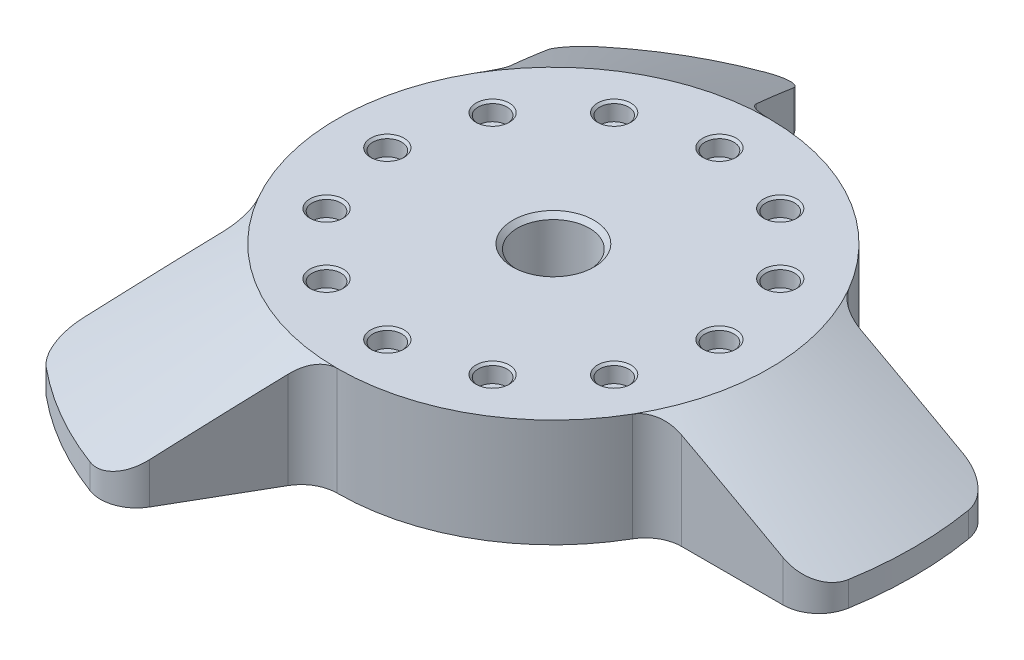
SolidWorks part; units mm, degrees
ref_plane "Front Plane" through (0, 0, 0) normal (0, 0, 1) x (1, 0, 0)
ref_plane "Top Plane" through (0, 0, 0) normal (0, 1, 0) x (1, 0, 0)
ref_plane "Right Plane" through (0, 0, 0) normal (1, 0, 0) x (0, 0, -1)
sketch "Sketch1" plane through (0, 0, 0) normal (0, 1, 0) x (1, 0, 0)
  circle A0 centre (0, 0) radius 38.1
  circle A1 centre (0, 0) radius 6.35
  dimension "D1" = 76.2
  dimension "D2" = 12.7
extrude "Boss-Extrude1" add sketch "Sketch1" along normal blind 19.05
sketch "Sketch2" plane through (0, 0, 0) normal (0, -1, 0) x (1, 0, 0)
  line L0 (0, 0) -> (63.5, 0) construction
  line L1 (34.6352, -15.875) -> (61.4836, -15.875)
  line L2 (34.6352, 15.875) -> (61.4836, 15.875)
  line L3 (-31.0657, -22.0574) -> (-44.49, -45.3089)
  line L4 (-3.5694, -37.9324) -> (-16.9937, -61.1839)
  line L5 (-3.5694, 37.9324) -> (-16.9937, 61.1839)
  line L6 (-31.0657, 22.0574) -> (-44.49, 45.3089)
  line L7 (-31.75, 54.9926) -> (0, 0) construction
  arc A1 (61.4836, -15.875) -> (61.4836, 15.875) centre (0, 0) ccw
  circle A2 centre (0, 0) radius 38.1 construction
  arc A3 (34.6352, -15.875) -> (34.6352, 15.875) centre (0, 0) ccw
  arc A4 (-44.49, -45.3089) -> (-16.9937, -61.1839) centre (0, 0) ccw
  arc A5 (-31.0657, -22.0574) -> (-3.5694, -37.9324) centre (0, 0) ccw
  arc A6 (-16.9937, 61.1839) -> (-44.49, 45.3089) centre (0, 0) ccw
  arc A7 (-3.5694, 37.9324) -> (-31.0657, 22.0574) centre (0, 0) ccw
  dimension "D1" = 63.5
  dimension "D2" = 31.75
  dimension "D4" = 120
  dimension "D3" = 3
extrude "Boss-Extrude2" add sketch "Sketch2" against normal up to surface (19.05 mm away)
chamfer "Chamfer1" distance 25.4 angle 30 3 edges at (63.5, 19.05, 0) (-31.75, 19.05, -54.9926) (-31.75, 19.05, 54.9926)
fillet "Fillet1" radius 6.35 12 edges at (-31.0657, 9.525, 22.0574) (-31.0657, 9.525, -22.0574) (-3.5694, 9.525, -37.9324) (34.6352, 9.525, -15.875) (34.6352, 9.525, 15.875) (-3.5694, 9.525, 37.9324) (61.4836, 2.1927, 15.875) (61.4836, 2.1927, -15.875) (-16.9937, 2.1927, -61.1839) (-44.49, 2.1927, -45.3089) (-44.49, 2.1927, 45.3089) (-16.9937, 2.1927, 61.1839)
chamfer "Chamfer2" distance 0.8128 angle 45 2 edges at (0, 19.05, 6.35) (0, 0, 6.35)
sketch "Sketch3" plane through (0, 19.05, 0) normal (0, 1, 0) x (1, 0, 0)
  line L0 (0, 0) -> (-14.6368, -25.3516) construction
  line L1 (0, 0) -> (0, -29.2735) construction
  circle A1 centre (-14.6368, -25.3516) radius 2.54
  circle A2 centre (0, 0) radius 29.2735 construction
  arc A3 (32.9956, 19.05) -> (0, 38.1) centre (0, 0) ccw construction
  circle A4 centre (-25.3516, -14.6367) radius 2.54
  circle A5 centre (-29.2735, 0) radius 2.54
  circle A6 centre (-25.3516, 14.6368) radius 2.54
  circle A7 centre (-14.6367, 25.3516) radius 2.54
  circle A8 centre (0, 29.2735) radius 2.54
  circle A9 centre (14.6368, 25.3516) radius 2.54
  circle A10 centre (25.3516, 14.6367) radius 2.54
  circle A11 centre (29.2735, 0) radius 2.54
  circle A12 centre (25.3516, -14.6368) radius 2.54
  circle A13 centre (14.6367, -25.3516) radius 2.54
  circle A14 centre (0, -29.2735) radius 2.54
  dimension "D2" = 58.547
  dimension "D3" = 5.08
  dimension "D4" = 30
  dimension "D1" = 12
extrude "Cut-Extrude1" cut sketch "Sketch3" against normal blind 3.175
chamfer "Chamfer3" distance 0.4064 angle 45 12 edges at (-14.6368, 19.05, 27.8916) (0, 19.05, 31.8135) (14.6367, 19.05, 27.8916) (25.3516, 19.05, 17.1768) (29.2735, 19.05, 2.54) (25.3516, 19.05, -12.0967) (14.6368, 19.05, -22.8116) (0, 19.05, -26.7335) (-14.6367, 19.05, -22.8116) (-25.3516, 19.05, -12.0968) (-29.2735, 19.05, 2.54) (-25.3516, 19.05, 17.1767)
sketch3d "3DSketch1"
  line L0 (0, 19.05, 0) -> (0, 120.65, 0) construction
  line L1 (0, 19.05, 0) -> (0, 18.2372, 0) construction
  line L2 (0, 4.3853, 0) -> (0, 19.05, 0) construction
  line L3 (0, 19.05, 0) -> (101.6, 19.05, 0) construction
  line L4 (0, 19.05, 0) -> (0, 19.05, 101.6) construction
  dimension "D1" = 101.6
